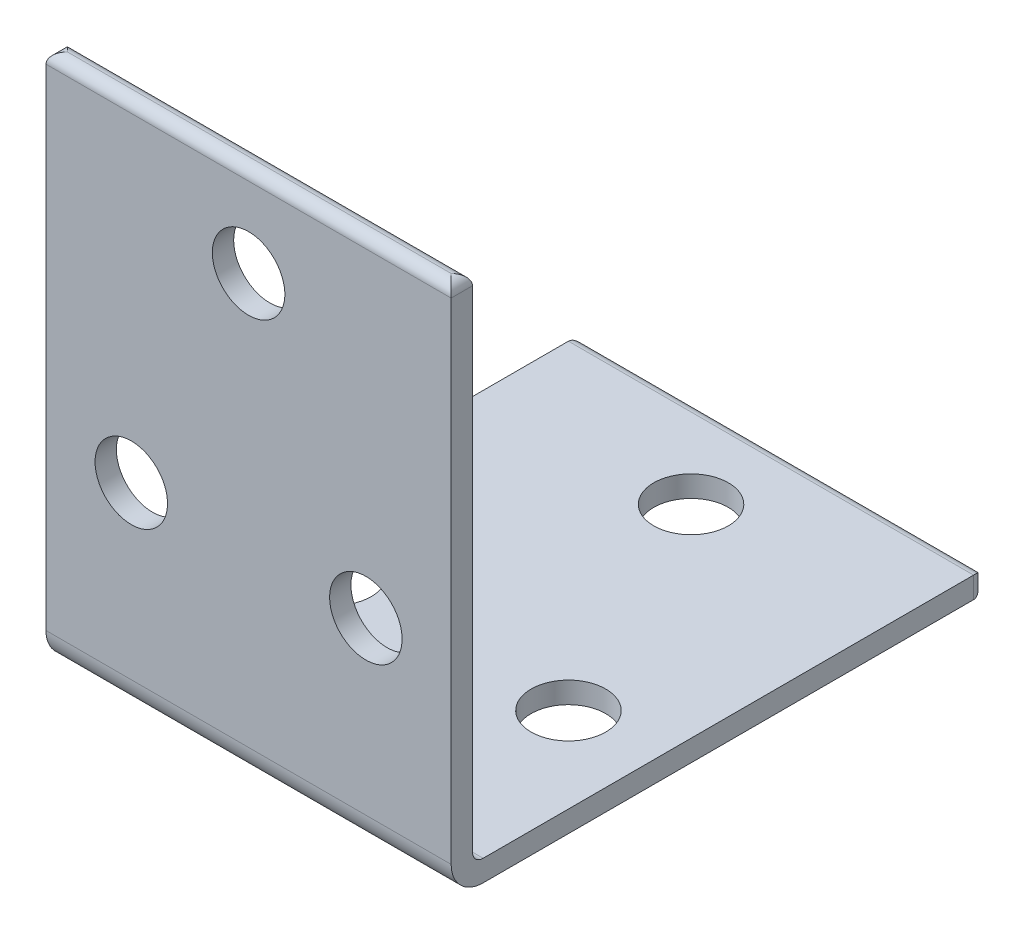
SolidWorks part; units mm, degrees
ref_plane "Front Plane" through (0, 0, 0) normal (0, 0, 1) x (1, 0, 0)
ref_plane "Top Plane" through (0, 0, 0) normal (0, 1, 0) x (1, 0, 0)
ref_plane "Right Plane" through (0, 0, 0) normal (1, 0, 0) x (0, 0, -1)
sketch "Sketch2" plane through (0, 0, 0) normal (1, 0, 0) x (0, 0, -1)
  line L3 (-50, 50) -> (-50, 3)
  line L4 (-47, 0) -> (0, 0)
  line L8 (-50, 50) -> (-48, 50)
  line L9 (0, 2) -> (0, 0)
  line L11 (-48, 50) -> (-48, 3)
  line L12 (-47, 2) -> (0, 2)
  arc A0 (-50, 3) -> (-47, 0) centre (-47, 3) ccw
  arc A2 (-48, 3) -> (-47, 2) centre (-47, 3) ccw
  point P12 (-50, 0)
  dimension "D3" = 3
  dimension "D5" = 2
  dimension "D6" = 1
  dimension "D1" = 2
  dimension "D2" = 50
  dimension "D4" = 50
extrude "Boss-Extrude1" add sketch "Sketch2" along normal blind 38
fillet "Fillet1" radius 1 8 edges at (19, 0, 0) (38, 1, 0) (19, 2, 0) (0, 1, 0) (19, 50, 50) (19, 50, 48) (0, 50, 49) (38, 50, 49)
hole_wizard "M8x1.25 Tapped Hole1" positions "3DSketch1" profile "Sketch5" tap size "M8x1.25" standard "ANSI Metric"
sketch3d "3DSketch1"
  line L0 (38, 3, 48) -> (38, 49, 48) construction
  line L1 (0, 3, 48) -> (0, 49, 48) construction
  line L2 (0, 49, 48) -> (38, 49, 48) construction
  point P0 (19, 41.5, 48)
  point P2 (30, 19, 48)
  point P4 (8, 19, 48)
  dimension "D1" = 8
  dimension "D2" = 8
  dimension "D3" = 7.5
  dimension "D4" = 19
  dimension "D5" = 30
  dimension "D6" = 30
sketch "Sketch5" plane through (19, 41.5, 48) normal (1, 0, 0) x (0, 1, 0)
  line L0 (0, 0) -> (0, 21.7929)
  line L1 (0, 21.7929) -> (3.4, 19.75)
  line L2 (3.4, 19.75) -> (3.4, 0)
  line L5 (3.4, 0) -> (0, 0)
  line L10 (0, 21.7929) -> (-3.4, 19.75) construction
  line L11 (0, -6.35) -> (0, 107.95) construction
  dimension "Tap Drill Dia." = 6.8
  dimension "Tap Drill Depth" = 19.75
  dimension "Drill Angle" = 118
hole_wizard "M8x1.0 Tapped Hole1" positions "Sketch9" profile "Sketch10" tap size "M8x1.0" standard "ANSI Metric"
sketch "Sketch9" plane through (0, 2, 0) normal (0, 1, 0) x (1, 0, 0)
  line L0 (38, -1) -> (38, -47) construction
  line L1 (38, -1) -> (0, -1) construction
  line L2 (0, -1) -> (0, -47) construction
  point P0 (19, -8.5)
  point P2 (8, -31)
  point P4 (30, -31)
  dimension "D1" = 19
  dimension "D2" = 7.5
  dimension "D3" = 30
  dimension "D4" = 30
  dimension "D5" = 8
  dimension "D6" = 8
sketch "Sketch10" plane through (19, 2, 8.5) normal (1, 0, 0) x (0, 0, 1)
  line L0 (0, 0) -> (0, 21.103)
  line L1 (0, 21.103) -> (3.5, 19)
  line L2 (3.5, 19) -> (3.5, 0)
  line L5 (3.5, 0) -> (0, 0)
  line L10 (0, 21.103) -> (-3.5, 19) construction
  line L11 (0, -6.35) -> (0, 107.95) construction
  dimension "Tap Drill Dia." = 7
  dimension "Tap Drill Depth" = 19
  dimension "Drill Angle" = 118
